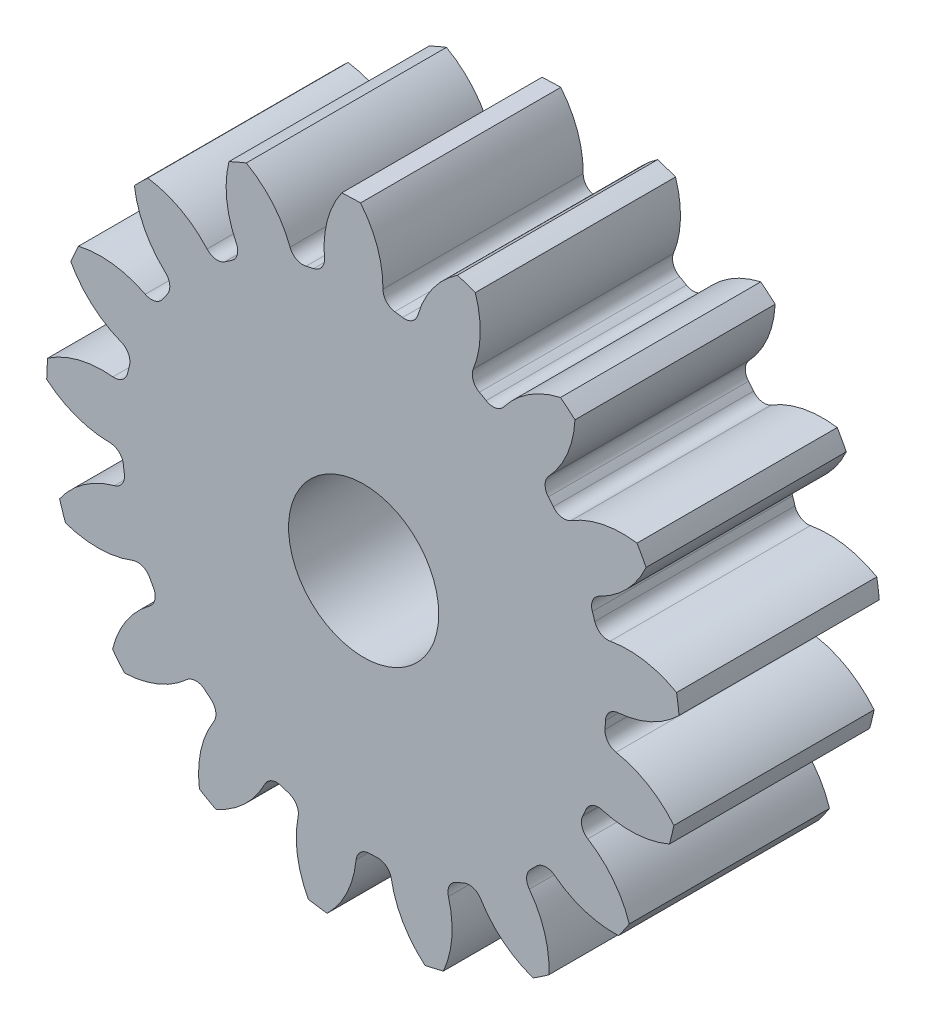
SolidWorks part; units mm, degrees
ref_plane "Front" through (0, 0, 0) normal (0, 0, 1) x (1, 0, 0)
ref_plane "Top" through (0, 0, 0) normal (0, 1, 0) x (1, 0, 0)
ref_plane "Right" through (0, 0, 0) normal (1, 0, 0) x (0, 0, -1)
sketch "Sketch3" plane through (0, 0, 0) normal (0, 0, 1) x (1, 0, 0)
  circle A0 centre (0, 0) radius 160.8667
  dimension "od" = 321.7333
extrude "gearBody" add sketch "Sketch3" along normal blind 101.6
sketch "Sketch2" plane through (0, 0, 0) normal (0, 0, 1) x (1, 0, 0)
  line L0 (0, 0) -> (124.9576, 51.7591) construction
  line L1 (158.1478, -34.1353) -> (0, 0) construction
  line L2 (0, 0) -> (36.3143, 0) construction
  line L3 (143.8215, 5.6733) -> (142.4201, -20.8162) construction
  line L5 (143.1208, -7.5714) -> (0, 0) construction
  line L7 (0, 0) -> (135.2531, 0) construction
  arc A0 (135.2191, 3.0308) -> (134.1446, -17.2808) centre (0, 0) ccw construction
  arc A1 (160.0279, 16.4063) -> (157.4036, -33.1992) centre (0, 0) ccw construction
  arc A2 (143.8215, 5.6733) -> (142.4201, -20.8162) centre (0, 0) ccw construction
  arc A3 (122.4735, -8.4798) -> (122.6845, -4.4897) centre (0, 0) ccw
  arc A4 (158.1478, -34.1353) -> (128.0663, -15.7273) centre (118.799, -64.6544) ccw
  arc A5 (158.1478, -34.1353) -> (160.8667, 17.2586) centre (0, 0) ccw
  arc A6 (160.8667, 17.2586) -> (129.0108, 2.1273) centre (124.9576, 51.7591) cw
  arc A7 (122.6845, -4.4897) -> (129.0108, 2.1273) centre (129.5718, -4.7417) cw
  arc A8 (128.0663, -15.7273) -> (122.4735, -8.4798) centre (129.3489, -8.9558) cw
  point P6 (160.8667, 17.2586)
  point P22 (158.1478, -34.1353)
  dimension "baseDia" = 270.5062
  dimension "od" = 321.7333
  dimension "pd" = 287.8667
  dimension "rd" = 245.5333
  dimension "rFillet" = 6.8919
  dimension "pointX" = 160.8667
  dimension "pointY" = 17.2586
  dimension "CTT" = 26.4896
  dimension "flankCenterAngle" = 22.5
extrude "toothCut" cut sketch "Sketch2" along normal through all
pattern_circular "CirPattern1" count 17 over 360 about axis through (0, 0, 0) along (0, 0, 1) of "toothCut"
sketch "hub1Dia" plane through (0, 0, 0) normal (0, 0, -1) x (-1, 0, 0)
  circle A0 centre (0, 0) radius 12.7
  dimension "hub1Dia" = 25.4
sketch "hub2Dia" plane through (0, 0, 101.6) normal (0, 0, 1) x (1, 0, 0)
  circle A0 centre (0, 0) radius 12.7
  dimension "hub2dia" = 25.4
sketch "boreDia" plane through (0, 0, 0) normal (0, 0, 1) x (1, 0, 0)
  circle A0 centre (0, 0) radius 38.1
  dimension "boreDia" = 76.2
extrude "bore" cut sketch "boreDia" against normal mid plane 25400
